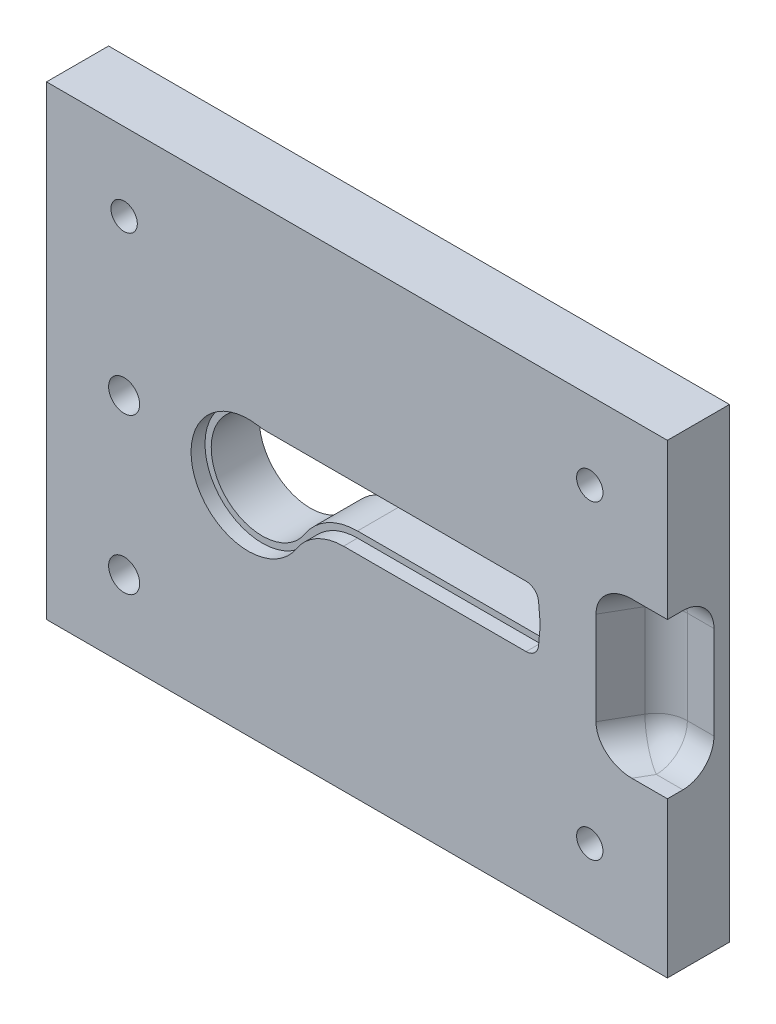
SolidWorks part; units mm, degrees
ref_plane "Plan1" through (0, 0, 0) normal (0, 0, 1) x (1, 0, 0)
ref_plane "Plan2" through (0, 0, 0) normal (0, 1, 0) x (1, 0, 0)
ref_plane "Plan3" through (0, 0, 0) normal (1, 0, 0) x (0, 0, -1)
sketch "Esquisse1" plane through (0, 0, 0) normal (0, 0, 1) x (1, 0, 0)
  line L1 (0, 0) -> (200, 0)
  line L2 (0, 0) -> (0, 150)
  line L3 (0, 150) -> (200, 150)
  line L4 (200, 0) -> (200, 150)
  dimension "D1" = 150
  dimension "D2" = 200
extrude "Base-Extrusion" add sketch "Esquisse1" along normal blind 20
sketch "Esquisse2" plane through (0, 0, 20) normal (0, 0, 1) x (1, 0, 0)
  line L0 (-10, 70) -> (90, 70) construction
  line L1 (0, 0) -> (200, 0) construction
  line L2 (20.3045, 78.12) -> (209.4484, 78.12) construction
  line L3 (71.0782, 85.935) -> (154.4898, 85.935)
  line L4 (156.5121, 84.0819) -> (157.0337, 78.12)
  line L5 (156.5121, 72.1581) -> (157.0337, 78.12)
  line L6 (95.6814, 70.305) -> (154.4898, 70.305)
  line L7 (200, 0) -> (200, 150) construction
  arc A0 (67.7404, 86.2151) -> (78.8329, 61.1069) centre (65, 70) ccw
  arc A1 (154.4898, 85.935) -> (156.5121, 84.0819) centre (154.4898, 83.905) cw
  arc A2 (71.0782, 85.935) -> (67.7404, 86.2151) centre (71.0782, 105.965) cw
  arc A3 (154.4898, 70.305) -> (156.5121, 72.1581) centre (154.4898, 72.335) ccw
  arc A4 (95.6814, 70.305) -> (78.8329, 61.1069) centre (95.6814, 50.275) ccw
  point P13 (156.35, 85.935)
  dimension "D2" = 32.89
  dimension "D6" = 91.35
  dimension "D7" = 2.03
  dimension "D8" = 20.03
  dimension "D9" = 20.03
  dimension "D10" = 135
  dimension "D1" = 70
  dimension "D3" = 8.12
  dimension "D4" = 7.815
  dimension "D5" = 95
extrude "Enlèv. mat.-Extru.1" cut sketch "Esquisse2" against normal through all
sketch "Esquisse10" plane through (0, 0, 20) normal (0, 0, 1) x (1, 0, 0)
  line L8 (158.5045, 71.9838) -> (159.0414, 78.12)
  line L9 (95.6814, 68.305) -> (154.4898, 68.305)
  line L10 (159.0414, 78.12) -> (158.5045, 84.2562)
  line L11 (154.4898, 87.935) -> (71.0782, 87.935)
  line L12 (158.5045, 71.9838) -> (159.0414, 78.12)
  line L13 (95.6814, 68.305) -> (154.4898, 68.305)
  line L14 (159.0414, 78.12) -> (158.5045, 84.2562)
  line L15 (154.4898, 87.935) -> (71.0782, 87.935)
  arc A10 (154.4898, 68.305) -> (158.5045, 71.9838) centre (154.4898, 72.335) ccw
  arc A11 (95.6814, 68.305) -> (80.5153, 60.0253) centre (95.6814, 50.275) ccw
  arc A12 (68.0737, 88.1871) -> (80.5153, 60.0253) centre (65, 70) ccw
  arc A13 (68.0737, 88.1871) -> (71.0782, 87.935) centre (71.0782, 105.965) ccw
  arc A14 (158.5045, 84.2562) -> (154.4898, 87.935) centre (154.4898, 83.905) ccw
  arc A15 (154.4898, 68.305) -> (158.5045, 71.9838) centre (154.4898, 72.335) ccw
  arc A16 (95.6814, 68.305) -> (80.5153, 60.0253) centre (95.6814, 50.275) ccw
  arc A17 (68.0737, 88.1871) -> (80.5153, 60.0253) centre (65, 70) ccw
  arc A18 (68.0737, 88.1871) -> (71.0782, 87.935) centre (71.0782, 105.965) ccw
  arc A19 (158.5045, 84.2562) -> (154.4898, 87.935) centre (154.4898, 83.905) ccw
  dimension "D1" = 2
extrude "Enlèv. mat.-Extru.9" cut sketch "Esquisse10" against normal blind 4.5
hole_wizard "Trou taraudé M10x1.52" positions "Esquisse15" profile "Esquisse14" tap size "M10x1.5" standard "ISO"
sketch "Esquisse15" plane through (0, 0, 20) normal (0, 0, 1) x (1, 0, 0)
  line L0 (0, 0) -> (200, 0) construction
  line L1 (200, 0) -> (200, 150) construction
  line L2 (200, 150) -> (0, 150) construction
  point P0 (175, 125)
  point P1 (25, 125)
  point P2 (25, 25)
  point P3 (175, 25)
  dimension "D1" = 100
  dimension "D2" = 25
  dimension "D3" = 150
  dimension "D4" = 150
  dimension "D5" = 100
  dimension "D6" = 25
  dimension "D7" = 25
  dimension "D8" = 25
sketch "Esquisse14" plane through (175, 125, 20) normal (1, 0, 0) x (0, -1, 0)
  line L0 (0, 0) -> (0, 20)
  line L1 (0, 20) -> (4.25, 20)
  line L2 (4.25, 20) -> (4.25, 0)
  line L5 (4.25, 0) -> (0, 0)
  line L11 (0, -6.35) -> (0, 107.95) construction
  dimension "Diamètre du perçage jusqu'au prochain" = 8.5
  dimension "Profondeur du perçage jusqu'au prochain" = 20
sketch "Esquisse16" plane through (0, 0, 0) normal (0, 0, -1) x (-1, 0, 0)
  circle A0 centre (-25, 125) radius 13
  circle A1 centre (-25, 25) radius 13
  circle A2 centre (-175, 25) radius 13
  circle A3 centre (-175, 125) radius 13
  dimension "D1" = 26
  dimension "D2" = 26
  dimension "D3" = 26
  dimension "D4" = 26
extrude "Enlèv. mat.-Extru.10" cut sketch "Esquisse16" against normal blind 5
sketch "Esquisse17" plane through (0, 0, 20) normal (0, 0, 1) x (1, 0, 0)
  line L0 (200, 0) -> (200, 150) construction
  line L1 (200, 100) -> (177, 100)
  line L2 (200, 100) -> (200, 50)
  line L3 (200, 50) -> (177, 50)
  line L4 (177, 100) -> (177, 50)
  line L5 (0, 0) -> (200, 0) construction
  dimension "D1" = 50
  dimension "D2" = 50
  dimension "D3" = 23
extrude "Enlèv. mat.-Extru.11" cut sketch "Esquisse17" against normal blind 15
draft "Dépouille1" type of draft neutral plane draft angle 30 faces to draft 1 parameters "D1"=30
fillet "Congé1" radius 10 5 edges at (192.8301, 50, 5) (185.6603, 75, 5) (181.3301, 50, 12.5) (192.8301, 100, 5) (181.3301, 100, 12.5)
sketch "Esquisse18" plane through (0, 0, 20) normal (0, 0, 1) x (1, 0, 0)
  line L0 (-8.1721, 125) -> (45, 125)
  line L1 (45, 125) -> (45, 70)
  line L2 (65, 70) -> (45, 70)
  line L3 (65, 70) -> (82.4134, 78.12)
  line L4 (82.4134, 78.12) -> (212.9104, 78.12)
  line L5 (0, 150) -> (0, 0) construction
  dimension "D1" = 45
  dimension "D2" = 25
  dimension "D3" = 8.12
hole_wizard "Trou taraudé M103" positions "Esquisse20" profile "Esquisse19" tap size "M10" standard "ISO"
sketch "Esquisse20" plane through (0, 0, 20) normal (0, 0, 1) x (1, 0, 0)
  line L0 (0, 75) -> (65.7488, 75) construction
  line L1 (0, 150) -> (0, 0) construction
  point P0 (25, 75)
  point P3 (25, 25)
sketch "Esquisse19" plane through (25, 75, 20) normal (1, 0, 0) x (0, -1, 0)
  line L0 (0, 0) -> (0, 30.0537)
  line L1 (0, 30.0537) -> (4.25, 27.5)
  line L2 (4.25, 27.5) -> (4.25, 20)
  line L3 (4.25, 20) -> (5, 20)
  line L4 (5, 20) -> (5, 0)
  line L5 (5, 0) -> (0, 0)
  line L10 (0, 30.0537) -> (-4.25, 27.5) construction
  line L11 (0, -6.35) -> (0, 107.95) construction
  dimension "Diamètre du trou pour taraudage" = 8.5
  dimension "Profondeur du trou pour taraudage" = 27.5
  dimension "Diamètre principal du filetage" = 10
  dimension "Profondeur du filetage" = 20
  dimension "Angle de pointe" = 118
sketch "Esquisse21" plane through (0, 0, 0) normal (0, 0, -1) x (-1, 0, 0)
  circle A0 centre (-25, 75) radius 13
  circle A1 centre (-25, 125) radius 13 construction
extrude "Extrusion1" cut sketch "Esquisse21" against normal up to surface (5 mm away)
